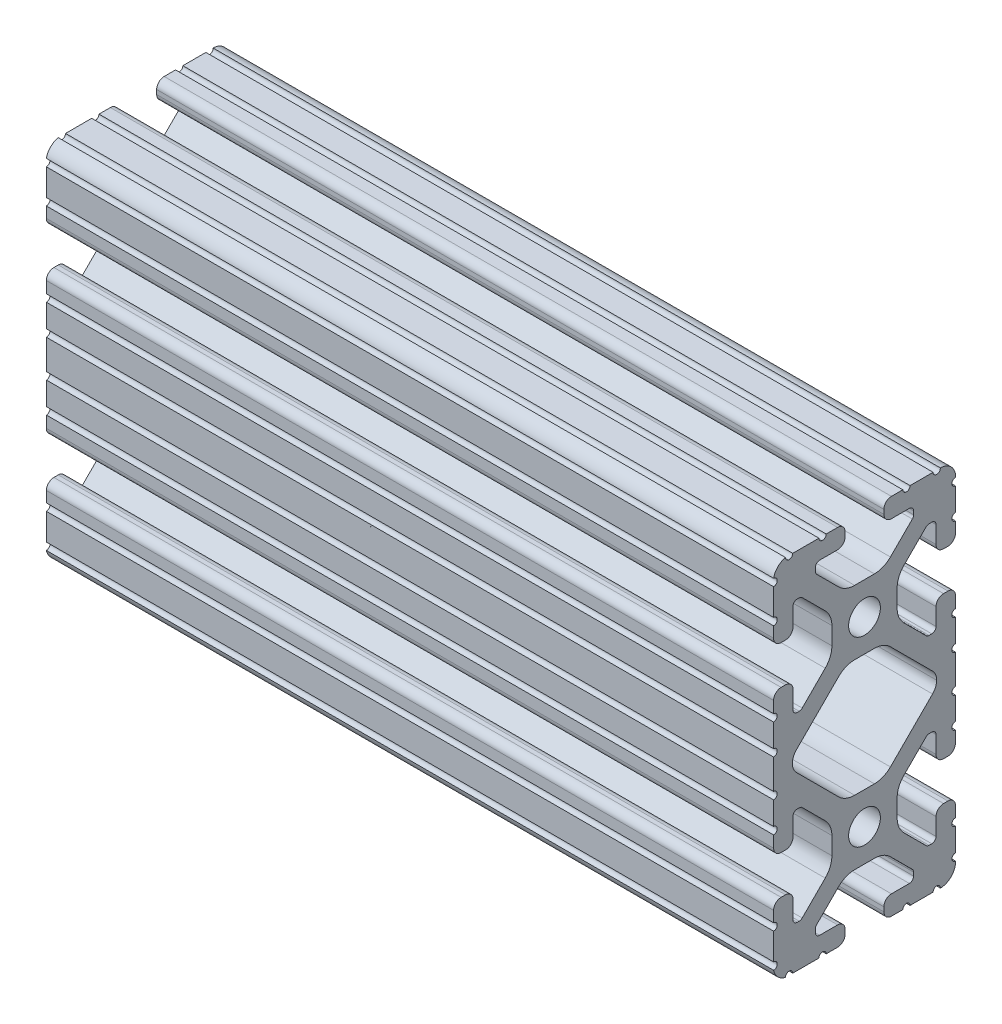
SolidWorks part; units mm, degrees
ref_plane "Front" through (0, 0, 0) normal (0, 0, 1) x (1, 0, 0)
ref_plane "Top" through (0, 0, 0) normal (0, 1, 0) x (1, 0, 0)
ref_plane "Right" through (0, 0, 0) normal (1, 0, 0) x (0, 0, -1)
sketch "Sketch1" plane through (0, 0, 0) normal (1, 0, 0) x (0, -1, 0)
  line L2 (30.3513, 26.5282) -> (39.1767, 35.3536)
  line L3 (40.5679, 38.7122) -> (40.5679, 42.8592)
  line L4 (39.1767, 46.2178) -> (30.3513, 55.0433)
  line L5 (26.1972, 55.0433) -> (17.3719, 46.2178)
  line L6 (15.9807, 42.8592) -> (15.9807, 38.7122)
  line L7 (17.3719, 35.3536) -> (26.1972, 26.5282)
  line L8 (37.19, 54.3201) -> (37.19, 54.8827)
  line L9 (38.079, 55.7717) -> (41.6855, 55.7717)
  line L10 (43.2603, 57.3465) -> (43.2603, 58.2825)
  line L11 (41.707, 59.8357) -> (39.2718, 59.8357)
  line L12 (37.7478, 59.8357) -> (32.9194, 59.8357)
  line L13 (31.3954, 59.8357) -> (25.1532, 59.8357)
  line L14 (23.6292, 59.8357) -> (18.8007, 59.8357)
  line L15 (17.2767, 59.8357) -> (14.8415, 59.8357)
  line L16 (13.2883, 58.2825) -> (13.2883, 57.3465)
  line L17 (14.8631, 55.7717) -> (18.4695, 55.7717)
  line L18 (19.3585, 54.8827) -> (19.3585, 54.3201)
  line L19 (19.0981, 53.6915) -> (14.4218, 49.0151)
  line L20 (11.0632, 47.6239) -> (7.3854, 47.6239)
  line L21 (4.0268, 49.0151) -> (-0.6496, 53.6915)
  line L22 (-0.91, 54.3201) -> (-0.91, 54.8827)
  line L23 (-0.021, 55.7717) -> (3.5855, 55.7717)
  line L24 (5.1603, 57.3465) -> (5.1603, 58.2663)
  line L25 (3.7154, 59.8357) -> (1.3285, 59.8357)
  line L26 (-0.1955, 59.8357) -> (-5.022, 59.8357)
  line L27 (-9.8257, 55.1609) -> (-9.8257, 50.3354)
  line L28 (-9.8257, 48.8114) -> (-9.8257, 46.4245)
  line L29 (-8.2509, 44.8497) -> (-7.3365, 44.8497)
  line L30 (-5.7617, 46.4245) -> (-5.7617, 50.1837)
  line L31 (-4.8727, 51.0727) -> (-4.1464, 51.0727)
  line L32 (-3.5178, 50.8123) -> (1.0767, 46.2178)
  line L33 (2.4679, 42.8592) -> (2.4679, 38.7122)
  line L34 (1.0767, 35.3536) -> (-3.5178, 30.7591)
  line L35 (-4.1464, 30.4987) -> (-4.8727, 30.4987)
  line L36 (-5.7617, 31.3877) -> (-5.7617, 35.1469)
  line L37 (-7.3365, 36.7217) -> (-8.2509, 36.7217)
  line L38 (-9.8257, 35.1469) -> (-9.8257, 32.76)
  line L39 (-9.8257, 31.236) -> (-9.8257, 25.7497)
  line L40 (-5.773, 21.7357) -> (-0.1955, 21.7357)
  line L41 (1.3285, 21.7357) -> (3.5855, 21.7357)
  line L42 (5.1603, 23.3105) -> (5.1603, 24.2249)
  line L43 (3.5855, 25.7997) -> (-0.1737, 25.7997)
  line L44 (-1.0627, 26.6887) -> (-1.0627, 27.0985)
  line L45 (-0.8023, 27.7272) -> (4.0268, 32.5563)
  line L46 (7.3854, 33.9475) -> (11.0632, 33.9475)
  line L47 (14.4218, 32.5563) -> (19.2509, 27.7272)
  line L48 (19.5113, 27.0985) -> (19.5113, 26.6887)
  line L49 (18.6223, 25.7997) -> (14.8631, 25.7997)
  line L50 (13.2883, 24.2249) -> (13.2883, 23.3105)
  line L51 (14.8631, 21.7357) -> (17.2767, 21.7357)
  line L52 (18.8007, 21.7357) -> (23.6292, 21.7357)
  line L53 (25.1532, 21.7357) -> (31.3954, 21.7357)
  line L54 (32.9194, 21.7357) -> (37.7478, 21.7357)
  line L55 (39.2718, 21.7357) -> (41.6855, 21.7357)
  line L56 (43.2603, 23.3105) -> (43.2603, 24.2249)
  line L57 (41.6855, 25.7997) -> (37.9263, 25.7997)
  line L58 (37.0373, 26.6887) -> (37.0373, 27.0985)
  line L59 (37.2977, 27.7272) -> (42.1268, 32.5563)
  line L60 (45.4854, 33.9475) -> (49.1632, 33.9475)
  line L61 (52.5218, 32.5563) -> (57.3509, 27.7272)
  line L62 (57.6113, 27.0985) -> (57.6113, 26.6887)
  line L63 (56.7223, 25.7997) -> (52.9631, 25.7997)
  line L64 (51.3883, 24.2249) -> (51.3883, 23.3105)
  line L65 (52.9631, 21.7357) -> (55.2201, 21.7357)
  line L66 (56.7441, 21.7357) -> (62.3216, 21.7357)
  line L67 (66.3743, 25.7497) -> (66.3743, 31.236)
  line L68 (66.3743, 32.76) -> (66.3743, 35.1469)
  line L69 (64.7995, 36.7217) -> (63.8851, 36.7217)
  line L70 (62.3103, 35.1469) -> (62.3103, 31.3877)
  line L71 (61.4213, 30.4987) -> (60.6949, 30.4987)
  line L72 (60.0663, 30.7591) -> (55.4719, 35.3536)
  line L73 (54.0807, 38.7122) -> (54.0807, 42.8592)
  line L74 (55.4719, 46.2178) -> (60.0663, 50.8123)
  line L75 (60.6949, 51.0727) -> (61.4213, 51.0727)
  line L76 (62.3103, 50.1837) -> (62.3103, 46.4245)
  line L77 (63.8851, 44.8497) -> (64.7995, 44.8497)
  line L78 (66.3743, 46.4245) -> (66.3743, 48.8114)
  line L79 (66.3743, 50.3354) -> (66.3743, 55.1609)
  line L80 (61.5705, 59.8357) -> (56.7441, 59.8357)
  line L81 (55.2201, 59.8357) -> (52.8332, 59.8357)
  line L82 (51.3883, 58.2663) -> (51.3883, 57.3465)
  line L83 (52.9631, 55.7717) -> (56.5695, 55.7717)
  line L84 (57.4585, 54.8827) -> (57.4585, 54.3201)
  line L85 (57.1981, 53.6915) -> (52.5218, 49.0151)
  line L86 (49.1632, 47.6239) -> (45.4854, 47.6239)
  line L87 (42.1268, 49.0151) -> (37.4504, 53.6915)
  arc A0 (39.1767, 35.3536) -> (40.5679, 38.7122) centre (35.8181, 38.7122) ccw
  arc A1 (30.3513, 55.0433) -> (28.2743, 55.8988) centre (28.2858, 52.9778) ccw
  arc A2 (28.2743, 55.8988) -> (26.1972, 55.0433) centre (28.2627, 52.9778) ccw
  arc A3 (17.3719, 46.2178) -> (15.9807, 42.8592) centre (20.7305, 42.8592) ccw
  arc A4 (15.9807, 38.7122) -> (17.3719, 35.3536) centre (20.7305, 38.7122) ccw
  arc A5 (26.1972, 26.5282) -> (28.2743, 25.6726) centre (28.2627, 28.5936) ccw
  arc A6 (28.2743, 25.6726) -> (30.3513, 26.5282) centre (28.2858, 28.5936) ccw
  circle A7 centre (47.3243, 40.7857) radius 3.3274
  circle A8 centre (9.2243, 40.7857) radius 3.3274
  arc A9 (40.5679, 42.8592) -> (39.1767, 46.2178) centre (35.8181, 42.8592) ccw
  arc A10 (38.079, 55.7717) -> (37.19, 54.8827) centre (38.079, 54.8827) ccw
  arc A11 (41.6855, 55.7717) -> (43.2603, 57.3465) centre (41.6855, 57.3465) ccw
  arc A12 (43.2603, 58.2825) -> (41.707, 59.8357) centre (41.707, 58.2825) ccw
  arc A13 (37.7478, 59.8357) -> (39.2718, 59.8357) centre (38.5098, 59.8357) ccw
  arc A14 (31.3954, 59.8357) -> (32.9194, 59.8357) centre (32.1574, 59.8357) ccw
  arc A15 (23.6292, 59.8357) -> (25.1532, 59.8357) centre (24.3912, 59.8357) ccw
  arc A16 (17.2767, 59.8357) -> (18.8007, 59.8357) centre (18.0387, 59.8357) ccw
  arc A17 (14.8415, 59.8357) -> (13.2883, 58.2825) centre (14.8415, 58.2825) ccw
  arc A18 (13.2883, 57.3465) -> (14.8631, 55.7717) centre (14.8631, 57.3465) ccw
  arc A19 (19.3585, 54.8827) -> (18.4695, 55.7717) centre (18.4695, 54.8827) ccw
  arc A20 (19.0981, 53.6915) -> (19.3585, 54.3201) centre (18.4695, 54.3201) ccw
  arc A21 (11.0632, 47.6239) -> (14.4218, 49.0151) centre (11.0632, 52.3737) ccw
  arc A22 (4.0268, 49.0151) -> (7.3854, 47.6239) centre (7.3854, 52.3737) ccw
  arc A23 (-0.91, 54.3201) -> (-0.6496, 53.6915) centre (-0.021, 54.3201) ccw
  arc A24 (-0.021, 55.7717) -> (-0.91, 54.8827) centre (-0.021, 54.8827) ccw
  arc A25 (3.5855, 55.7717) -> (5.1603, 57.3465) centre (3.5855, 57.3465) ccw
  arc A26 (5.1603, 58.2663) -> (3.7154, 59.8357) centre (3.5855, 58.2663) ccw
  arc A27 (-0.1955, 59.8357) -> (1.3285, 59.8357) centre (0.5665, 59.8357) ccw
  arc A28 (-6.5453, 59.8825) -> (-5.022, 59.8357) centre (-5.7836, 59.8591) ccw
  arc A29 (-6.5453, 59.8825) -> (-9.8633, 56.684) centre (-6.6287, 56.6488) ccw
  arc A30 (-9.8257, 55.1609) -> (-9.8633, 56.684) centre (-9.8257, 55.9229) ccw
  arc A31 (-9.8257, 48.8114) -> (-9.8257, 50.3354) centre (-9.8257, 49.5734) ccw
  arc A32 (-9.8257, 46.4245) -> (-8.2509, 44.8497) centre (-8.2509, 46.4245) ccw
  arc A33 (-7.3365, 44.8497) -> (-5.7617, 46.4245) centre (-7.3365, 46.4245) ccw
  arc A34 (-4.8727, 51.0727) -> (-5.7617, 50.1837) centre (-4.8727, 50.1837) ccw
  arc A35 (-3.5178, 50.8123) -> (-4.1464, 51.0727) centre (-4.1464, 50.1837) ccw
  arc A36 (2.4679, 42.8592) -> (1.0767, 46.2178) centre (-2.2819, 42.8592) ccw
  arc A37 (1.0767, 35.3536) -> (2.4679, 38.7122) centre (-2.2819, 38.7122) ccw
  arc A38 (-4.1464, 30.4987) -> (-3.5178, 30.7591) centre (-4.1464, 31.3877) ccw
  arc A39 (-5.7617, 31.3877) -> (-4.8727, 30.4987) centre (-4.8727, 31.3877) ccw
  arc A40 (-5.7617, 35.1469) -> (-7.3365, 36.7217) centre (-7.3365, 35.1469) ccw
  arc A41 (-8.2509, 36.7217) -> (-9.8257, 35.1469) centre (-8.2509, 35.1469) ccw
  arc A42 (-9.8257, 31.236) -> (-9.8257, 32.76) centre (-9.8257, 31.998) ccw
  arc A43 (-9.8257, 24.2257) -> (-9.8257, 25.7497) centre (-9.8257, 24.9877) ccw
  arc A44 (-9.8257, 24.2257) -> (-7.297, 21.7357) centre (-6.6712, 24.9002) ccw
  arc A45 (-5.773, 21.7357) -> (-7.297, 21.7357) centre (-6.535, 21.7357) ccw
  arc A46 (1.3285, 21.7357) -> (-0.1955, 21.7357) centre (0.5665, 21.7357) ccw
  arc A47 (3.5855, 21.7357) -> (5.1603, 23.3105) centre (3.5855, 23.3105) ccw
  arc A48 (5.1603, 24.2249) -> (3.5855, 25.7997) centre (3.5855, 24.2249) ccw
  arc A49 (-1.0627, 26.6887) -> (-0.1737, 25.7997) centre (-0.1737, 26.6887) ccw
  arc A50 (-0.8023, 27.7272) -> (-1.0627, 27.0985) centre (-0.1737, 27.0985) ccw
  arc A51 (7.3854, 33.9475) -> (4.0268, 32.5563) centre (7.3854, 29.1977) ccw
  arc A52 (14.4218, 32.5563) -> (11.0632, 33.9475) centre (11.0632, 29.1977) ccw
  arc A53 (19.5113, 27.0985) -> (19.2509, 27.7272) centre (18.6223, 27.0985) ccw
  arc A54 (18.6223, 25.7997) -> (19.5113, 26.6887) centre (18.6223, 26.6887) ccw
  arc A55 (14.8631, 25.7997) -> (13.2883, 24.2249) centre (14.8631, 24.2249) ccw
  arc A56 (13.2883, 23.3105) -> (14.8631, 21.7357) centre (14.8631, 23.3105) ccw
  arc A57 (18.8007, 21.7357) -> (17.2767, 21.7357) centre (18.0387, 21.7357) ccw
  arc A58 (25.1532, 21.7357) -> (23.6292, 21.7357) centre (24.3912, 21.7357) ccw
  arc A59 (32.9194, 21.7357) -> (31.3954, 21.7357) centre (32.1574, 21.7357) ccw
  arc A60 (39.2718, 21.7357) -> (37.7478, 21.7357) centre (38.5098, 21.7357) ccw
  arc A61 (41.6855, 21.7357) -> (43.2603, 23.3105) centre (41.6855, 23.3105) ccw
  arc A62 (43.2603, 24.2249) -> (41.6855, 25.7997) centre (41.6855, 24.2249) ccw
  arc A63 (37.0373, 26.6887) -> (37.9263, 25.7997) centre (37.9263, 26.6887) ccw
  arc A64 (37.2977, 27.7272) -> (37.0373, 27.0985) centre (37.9263, 27.0985) ccw
  arc A65 (45.4854, 33.9475) -> (42.1268, 32.5563) centre (45.4854, 29.1977) ccw
  arc A66 (52.5218, 32.5563) -> (49.1632, 33.9475) centre (49.1632, 29.1977) ccw
  arc A67 (57.6113, 27.0985) -> (57.3509, 27.7272) centre (56.7223, 27.0985) ccw
  arc A68 (56.7223, 25.7997) -> (57.6113, 26.6887) centre (56.7223, 26.6887) ccw
  arc A69 (52.9631, 25.7997) -> (51.3883, 24.2249) centre (52.9631, 24.2249) ccw
  arc A70 (51.3883, 23.3105) -> (52.9631, 21.7357) centre (52.9631, 23.3105) ccw
  arc A71 (56.7441, 21.7357) -> (55.2201, 21.7357) centre (55.9821, 21.7357) ccw
  arc A72 (63.8456, 21.7357) -> (62.3216, 21.7357) centre (63.0836, 21.7357) ccw
  arc A73 (63.8456, 21.7357) -> (66.3743, 24.2257) centre (63.2122, 24.9079) ccw
  arc A74 (66.3743, 25.7497) -> (66.3743, 24.2257) centre (66.3743, 24.9877) ccw
  arc A75 (66.3743, 32.76) -> (66.3743, 31.236) centre (66.3743, 31.998) ccw
  arc A76 (66.3743, 35.1469) -> (64.7995, 36.7217) centre (64.7995, 35.1469) ccw
  arc A77 (63.8851, 36.7217) -> (62.3103, 35.1469) centre (63.8851, 35.1469) ccw
  arc A78 (61.4213, 30.4987) -> (62.3103, 31.3877) centre (61.4213, 31.3877) ccw
  arc A79 (60.0663, 30.7591) -> (60.6949, 30.4987) centre (60.6949, 31.3877) ccw
  arc A80 (54.0807, 38.7122) -> (55.4719, 35.3536) centre (58.8305, 38.7122) ccw
  arc A81 (55.4719, 46.2178) -> (54.0807, 42.8592) centre (58.8305, 42.8592) ccw
  arc A82 (60.6949, 51.0727) -> (60.0663, 50.8123) centre (60.6949, 50.1837) ccw
  arc A83 (62.3103, 50.1837) -> (61.4213, 51.0727) centre (61.4213, 50.1837) ccw
  arc A84 (62.3103, 46.4245) -> (63.8851, 44.8497) centre (63.8851, 46.4245) ccw
  arc A85 (64.7995, 44.8497) -> (66.3743, 46.4245) centre (64.7995, 46.4245) ccw
  arc A86 (66.3743, 50.3354) -> (66.3743, 48.8114) centre (66.3743, 49.5734) ccw
  arc A87 (66.4119, 56.684) -> (66.3743, 55.1609) centre (66.3743, 55.9229) ccw
  arc A88 (66.4119, 56.684) -> (63.0938, 59.8825) centre (63.1773, 56.6488) ccw
  arc A89 (61.5705, 59.8357) -> (63.0938, 59.8825) centre (62.3322, 59.8591) ccw
  arc A90 (55.2201, 59.8357) -> (56.7441, 59.8357) centre (55.9821, 59.8357) ccw
  arc A91 (52.8332, 59.8357) -> (51.3883, 58.2663) centre (52.9631, 58.2663) ccw
  arc A92 (51.3883, 57.3465) -> (52.9631, 55.7717) centre (52.9631, 57.3465) ccw
  arc A93 (57.4585, 54.8827) -> (56.5695, 55.7717) centre (56.5695, 54.8827) ccw
  arc A94 (57.1981, 53.6915) -> (57.4585, 54.3201) centre (56.5695, 54.3201) ccw
  arc A95 (49.1632, 47.6239) -> (52.5218, 49.0151) centre (49.1632, 52.3737) ccw
  arc A96 (42.1268, 49.0151) -> (45.4854, 47.6239) centre (45.4854, 52.3737) ccw
  arc A97 (37.19, 54.3201) -> (37.4504, 53.6915) centre (38.079, 54.3201) ccw
extrude "Extrude1" add sketch "Sketch1" along normal blind 152.4
